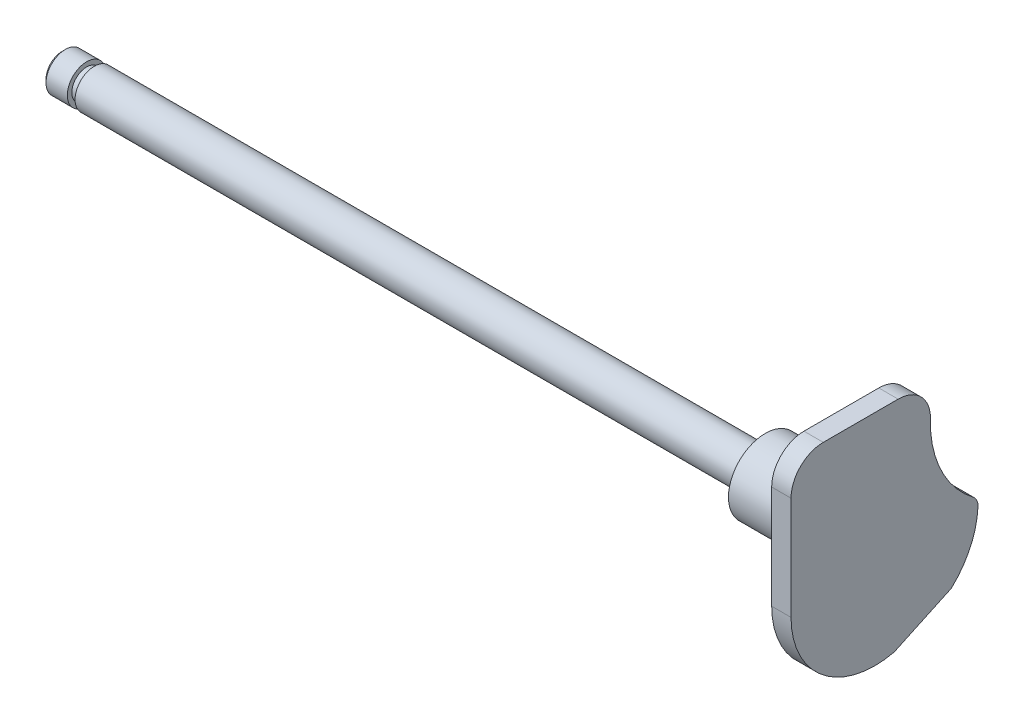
SolidWorks part; units mm, degrees
ref_plane "Face" through (0, 0, 0) normal (0, 0, 1) x (1, 0, 0)
ref_plane "Dessus" through (0, 0, 0) normal (0, 1, 0) x (1, 0, 0)
ref_plane "Droite" through (0, 0, 0) normal (1, 0, 0) x (0, 0, -1)
sketch "Esquisse1" plane through (0, 0, 0) normal (1, 0, 0) x (0, 0, -1)
  line L0 (-8, 7.5) -> (-8, -0.5)
  line L1 (-5.5, 10) -> (0.3041, 10)
  line L2 (0, -6.8246) -> (4.4252, -4.7611)
  arc A0 (-8, -0.5) -> (0, -6.8246) centre (-1.5, -0.5) ccw
  arc A1 (2.8032, 7.4312) -> (6.1005, 0.5251) centre (11.2, 7.2) ccw
  arc A2 (-5.5, 10) -> (-8, 7.5) centre (-5.5, 7.5) ccw
  arc A3 (2.8032, 7.4312) -> (0.3041, 10) centre (0.3041, 7.5) ccw
  arc A4 (4.4252, -4.7611) -> (6.4922, -0.3186) centre (0, 0) ccw
  arc A5 (6.1005, 0.5251) -> (6.4922, -0.3186) centre (5.4934, -0.2696) cw
  dimension "D2" = 13
  dimension "D7" = 2.5
  dimension "D8" = 8.4
  dimension "D9" = 13
  dimension "D11" = 1
  dimension "D1" = 10
  dimension "D3" = 1.5
  dimension "D4" = 0.5
  dimension "D5" = 11.2
  dimension "D6" = 7.2
  dimension "D10" = 65
extrude "Base-Extrusion" add sketch "Esquisse1" against normal blind 1.5
sketch "Esquisse2" plane through (-1.5, 0, 0) normal (-1, 0, 0) x (0, 0, 1)
  circle A0 centre (0, 0) radius 2.85
  dimension "D1" = 5.7
extrude "Boss.-Extru.1" add sketch "Esquisse2" along normal blind 8.5
sketch "Esquisse3" plane through (-10, 0, 0) normal (-1, 0, 0) x (0, 0, 1)
  circle A0 centre (0, 0) radius 1.5
  dimension "D1" = 3
extrude "Boss.-Extru.2" add sketch "Esquisse3" along normal blind 54.5
sketch "Esquisse4" plane through (0, 0, 0) normal (0, 0, 1) x (1, 0, 0)
  line L0 (2.5796, 0) -> (-66.7785, 0) construction
  line L1 (-1.5, 0) -> (0, 0) construction
  line L2 (-10, 2.85) -> (-10, -2.85) construction
  line L3 (-62.6, -1.15) -> (-62, -1.15)
  line L4 (-62.6, -1.15) -> (-62.6, -1.5)
  line L6 (-62, -1.15) -> (-62, -1.5)
  line L7 (-64.5, -1.5) -> (-10, -1.5) construction
  line L8 (-62.6, -1.5) -> (-62, -1.5)
  dimension "D1" = 52.6
  dimension "D2" = 2.3
  dimension "D3" = 0.6
revolve "Enlèvement de matière-Révolution1" cut sketch "Esquisse4" angle 360 about L0
chamfer "Chanfrein1" distance 0.25 angle 45 1 edges at (-64.5, 0, 1.5)
